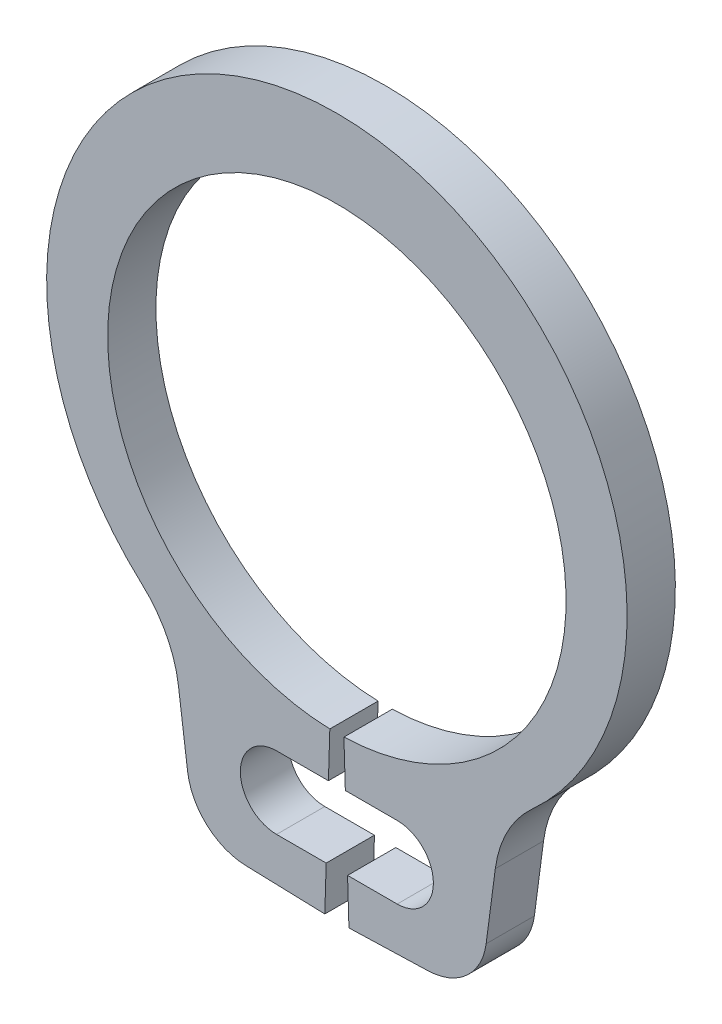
SolidWorks part; units mm, degrees
ref_plane "Plane1" through (0, 0, 0) normal (0, 0, 1) x (1, 0, 0)
ref_plane "Plane2" through (0, 0, 0) normal (0, 1, 0) x (1, 0, 0)
ref_plane "Plane3" through (0, 0, 0) normal (1, 0, 0) x (0, 0, -1)
extrude "Body" add sketch "BodySke" against normal blind 0.4
sketch "BodySke" plane through (0, 0, 0) normal (0, 0, 1) x (1, 0, 0)
  line L0 (-1.5431, 0) -> (1.5431, 0) construction
  line L1 (0, 0) -> (0, 2.55) construction
  line L2 (0.0585, -1.8991) -> (0.1, -3.2485)
  line L3 (-0.0585, -1.8991) -> (-0.1, -3.2485)
  line L4 (0, 0) -> (2.2545, -2.3409) construction
  line L5 (0, 0) -> (-2.2545, -2.3409) construction
  line L6 (0.1, -3.2485) -> (0.7569, -3.2282)
  line L7 (1.3132, -2.217) -> (1.2372, -2.7937)
  line L8 (-1.3132, -2.217) -> (-1.2372, -2.7937)
  line L9 (-0.1, -3.2485) -> (-0.7569, -3.2282)
  circle A0 centre (0, 0) radius 1.9 construction
  arc A1 (0.0585, -1.8991) -> (-0.0585, -1.8991) centre (0, 0) ccw
  arc A2 (1.5955, -1.6566) -> (-1.5955, -1.6566) centre (0, 0.1441) ccw construction
  arc A3 (0.1, -3.2485) -> (0.8139, -3.1464) centre (0, 0) ccw construction
  arc A4 (1.6165, -1.6378) -> (1.3132, -2.217) centre (2.2545, -2.3409) ccw
  arc A5 (-1.3132, -2.217) -> (-1.6165, -1.6378) centre (-2.2545, -2.3409) ccw
  arc A6 (-0.8139, -3.1464) -> (-0.1, -3.2485) centre (0, 0) ccw construction
  arc A7 (1.6165, -1.6378) -> (-1.6165, -1.6378) centre (0, 0.1441) ccw
  arc A8 (-1.3052, -2.2775) -> (1.3052, -2.2775) centre (0, 0) ccw construction
  circle A9 centre (0.5, -2.5769) radius 0.3
  circle A10 centre (-0.5, -2.5769) radius 0.3
  arc A11 (1.2372, -2.7937) -> (0.7569, -3.2282) centre (0.7415, -2.7285) cw
  arc A12 (-1.2372, -2.7937) -> (-0.7569, -3.2282) centre (-0.7415, -2.7285) ccw
  point P28 (1.2078, -3.0172)
  point P31 (-1.2078, -3.0172)
  dimension "GrooveDia" = 3.8
  dimension "D3" = 0.5
  dimension "LugRad" = 3.25
  dimension "HoleOffsetRad" = 2.625
  dimension "HoleDia" = 0.6
  dimension "D2" = 15
  dimension "LargeRad" = 2.55
  dimension "SmallRad" = 2.3
  dimension "Gap" = 0.2
  dimension "SmallAngle" = 87.845
  dimension "HoleSpacing" = 1
sketch "Clipboard" plane through (0, 0, 0) normal (0, 0, 1) x (1, 0, 0)
  line L0 (0, 0) -> (0.65, 0)
  line L1 (0, 0) -> (0, 0.4)
  line L2 (0, 0) -> (0, -1.35)
  circle A0 centre (0, 0) radius 0.3
  circle A1 centre (0, 0) radius 2
  dimension "HoleDia" = 0.6
  dimension "ShaftDia" = 4
  dimension "LargeSection" = 0.65
  dimension "SmallSection" = 0.4
  dimension "LugSection" = 1.35
sketch "NotSke" plane through (0, 0, 0) normal (0, 0, 1) x (1, 0, 0)
  line L0 (0.5, -2.2769) -> (0.5, -2.8769)
  line L1 (0.5, -2.8769) -> (-0.5, -2.8769)
  line L2 (-0.5, -2.8769) -> (-0.5, -2.2769)
  line L3 (-0.5, -2.2769) -> (0.5, -2.2769)
  circle A0 centre (0.5, -2.5769) radius 0.3 construction
  circle A1 centre (-0.5, -2.5769) radius 0.3 construction
extrude "Notch" cut sketch "NotSke" against normal through all
equation "' \"ShaftDia@Clipboard\" = 4"
equation "' \"Thickness@Body\" = 0.25"
equation "' \"GrooveDia@BodySke\" = 3.8"
equation "' \"LugSection@Clipboard\" = 1.35"
equation "' \"LargeSection@Clipboard\" = 0.65"
equation "' \"SmallSection@Clipboard\" = 0.4"
equation "' \"HoleDia@Clipboard\" = 0.6"
equation "' \"ShaftDia@Clipboard\" = 15"
equation "' \"Thickness@Body\" = 0.9"
equation "' \"GrooveDia@BodySke\" = 14.15"
equation "' \"LugSection@Clipboard\" = 2.8"
equation "' \"LargeSection@Clipboard\" = 1.8"
equation "' \"SmallSection@Clipboard\" = 1.05"
equation "' \"HoleDia@Clipboard\" = 1.2"
equation "\"Gap@BodySke\" =  \"Thickness@Body\" / 2"
equation "\"LargeRad@BodySke\" =  \"GrooveDia@BodySke\" / 2 +  \"LargeSection@Clipboard\""
equation "\"SmallRad@BodySke\" =  \"GrooveDia@BodySke\" / 2 +  \"SmallSection@Clipboard\""
equation "\"LugRad@BodySke\" = \"GrooveDia@BodySke\" / 2 + \"LugSection@Clipboard\""
equation "\"HoleOffsetRad@BodySke\" = (  \"ShaftDia@Clipboard\" / 2 + \"LugRad@BodySke\" ) / 2"
equation "\"HoleSpacing@BodySke\" = \"Gap@BodySke\"  * 2 +  \"HoleDia@Clipboard\""
equation "\"HoleDia@BodySke\" =  \"HoleDia@Clipboard\""
equation "\"SmallAngle@BodySke\" = atn(\"HoleSpacing@BodySke\" / 2 / sqr(\"HoleOffsetRad@BodySke\"  * \"HoleOffsetRad@BodySke\" - (\"HoleSpacing@BodySke\" / 2) * (\"HoleSpacing@BodySke\" / 2) ))  * 8 * ( 180 / 3.141593)"
